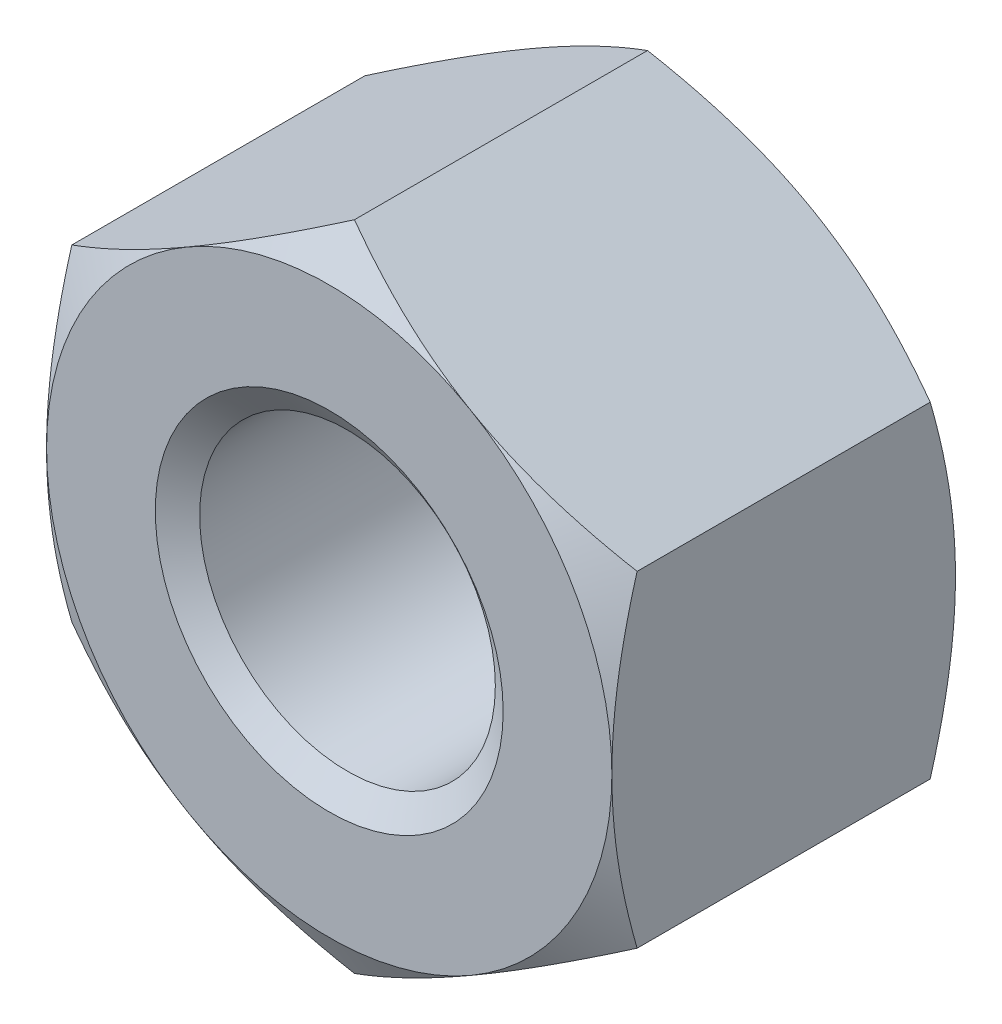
SolidWorks part; units mm, degrees
ref_plane "Plane1" through (0, 0, 0) normal (0, 0, 1) x (1, 0, 0)
ref_plane "Plane2" through (0, 0, 0) normal (0, 1, 0) x (1, 0, 0)
ref_plane "Plane3" through (0, 0, 0) normal (1, 0, 0) x (0, 0, -1)
revolve "EndChamfer" cut sketch "Sketch5"
sketch "Sketch5"
  line L0 (7.8746, 4) -> (7.4125, 3.34)
  line L1 (7.9254, 4) -> (7.8746, 4)
  line L2 (7.9254, 4) -> (7.9254, 3.34)
  line L3 (7.9254, 3.34) -> (7.4125, 3.34)
  line L6 (-0.0508, 4) -> (0, 4)
  line L7 (0, 4) -> (0.4621, 3.34)
  line L9 (0.4621, 3.34) -> (-0.0508, 3.34)
  line L10 (-0.0508, 3.34) -> (-0.0508, 4)
  line L11 (25.0375, 0) -> (38.388, 0) construction
  line L12 (7.9, 0) -> (0, 0) construction
extrude "BaseNut" add sketch "BaseNutSke" against normal blind 7.9
sketch "BaseNutSke" plane through (0, 0, 0) normal (0, 0, 1) x (1, 0, 0)
  line L6 (6.5, 3.7528) -> (6.5, -3.7528)
  line L7 (-6.5, 3.7528) -> (-6.5, -3.7528)
  line L8 (6.5, 3.7528) -> (0, 7.5056)
  line L9 (0, 7.5056) -> (-6.5, 3.7528)
  line L10 (-6.5, -3.7528) -> (0, -7.5056)
  line L11 (0, -7.5056) -> (6.5, -3.7528)
  circle A0 centre (0, 0) radius 3.4
  dimension "D4" = 6.5
  dimension "Tap_drill" = 6.8
  dimension "D1" = 120
  dimension "D2" = 6.5
  dimension "D3" = 6.5
  dimension "Width_flats" = 13
pattern_linear "ThdSchPat" [suppressed]
revolve "ThreadSchematic" cut sketch "ThdSchSke" angle 360 about L11
sketch "ThdSchSke" plane through (0, 0, 0) normal (0, 1, 0) x (1, 0, 0)
  line L0 (-4, 0.0254) -> (-3.4, 0.4455)
  line L1 (-3.4, 0.4455) -> (-1.7, 0.4455)
  line L2 (-1.7, 0.4455) -> (-1.7, -0.3947)
  line L3 (-1.7, -0.3947) -> (-3.4, -0.3947)
  line L4 (-3.4, -0.3947) -> (-4, 0.0254)
  line L5 (-3.175, 1.25) -> (3.175, 1.25) construction
  line L6 (0, 1.25) -> (0, -2.9874) construction
  line L7 (0, 7.4545) -> (0, 0.4201) construction
  dimension "D1" = 35
  dimension "VeeAngle" = 70
  dimension "SideAngle" = 55
  dimension "D2" = 0.0508
  dimension "OverCut" = 3.4
  dimension "Tap_Drill" = 6.8
  dimension "Advance" = 1.1213
  dimension "Thread_major" = 8
  dimension "Num_threads" = 8
  dimension "D4" = 50
  dimension "Offset1" = 7.9254
  dimension "ThreadMajor" = 4
  dimension "ChamferDepth" = 0.66
  dimension "Offset2" = 7.9762
sketch "Sketch3" plane through (0, 0, 0) normal (1, 0, 0) x (0, 0, -1)
  line L0 (7.9, 6.5) -> (7.3194, 7.5056)
  line L1 (7.3194, 7.5056) -> (7.3194, 17.5056)
  line L2 (7.3194, 17.5056) -> (17.9, 17.5056)
  line L3 (17.9, 17.5056) -> (17.9, 6.5)
  line L4 (17.9, 6.5) -> (7.9, 6.5)
  line L5 (7.9, 3.7528) -> (7.9, 7.5056) construction
  line L6 (7.9, 7.5056) -> (0, 7.5056) construction
  line L7 (0, 0) -> (38.6776, 0) construction
  line L8 (7.9, 0) -> (0, 0) construction
  line L9 (3.95, 7.5056) -> (3.95, 44.222) construction
  line L10 (0.5806, 17.5056) -> (-10, 17.5056)
  line L11 (-10, 17.5056) -> (-10, 6.5)
  line L12 (-10, 6.5) -> (0, 6.5)
  line L13 (0, 6.5) -> (0.5806, 7.5056)
  line L14 (0.5806, 7.5056) -> (0.5806, 17.5056)
  line L16 (7.9, 7.5056) -> (0, 7.5056) construction
  dimension "D1" = 6.5
  dimension "D2" = 30
  dimension "D3" = 10
  dimension "D4" = 10
revolve "Double-Chamfer" cut sketch "Sketch3" angle 360 about L7
equation "\"D2@BaseNutSke\" = \"Width_flats@BaseNutSke\" / 2"
equation "\"D3@BaseNutSke\" = \"Width_flats@BaseNutSke\" / 2"
equation "\"D1@Sketch3\" = \"Width_flats@BaseNutSke\" /2"
equation "\"D4@BaseNutSke\" = \"D3@BaseNutSke\""
equation "\"Thread_major@ThdSchSke\" = \"Thread_major@ThreadCosmetic\""
equation "\"Tap_drill@ThdSchSke\" = \"Tap_drill@BaseNutSke\""
equation "\"Overcut@ThdSchSke\" = \"Tap_drill@ThdSchSke\" * 0.5"
equation "\"Num_threads@ThdSchPat\" = int(  ( \"Thickness@BaseNut\" - 0.0508 ) / \"Advance@ThdSchSke\" + 0.999 )  + 1"
equation "\"Advance@ThdSchPat\" = ( \"Thickness@BaseNut\" - 0.0508 ) /  (\"Num_threads@ThdSchPat\" - 1) 'relax it"
equation "' \"Num_threads@ThdSchPat\" = \"Num_threads@ThdSchPat\" - sgn( \"Num_threads@ThdSchPat\" - 1) '---chamfered tips only---"
equation "\"ThreadMajor@Sketch5\" = \"Thread_major@ThreadCosmetic\" * 0.5"
equation "\"ChamferDepth@Sketch5\" = (\"Thread_major@ThreadCosmetic\" - \"Tap_drill@BaseNutSke\") * 0.55"
equation "\"Offset1@Sketch5\" = \"Thickness@BaseNut\" + 0.0254"
equation "\"Offset2@Sketch5\" = \"Offset1@Sketch5\" + 0.0508"
